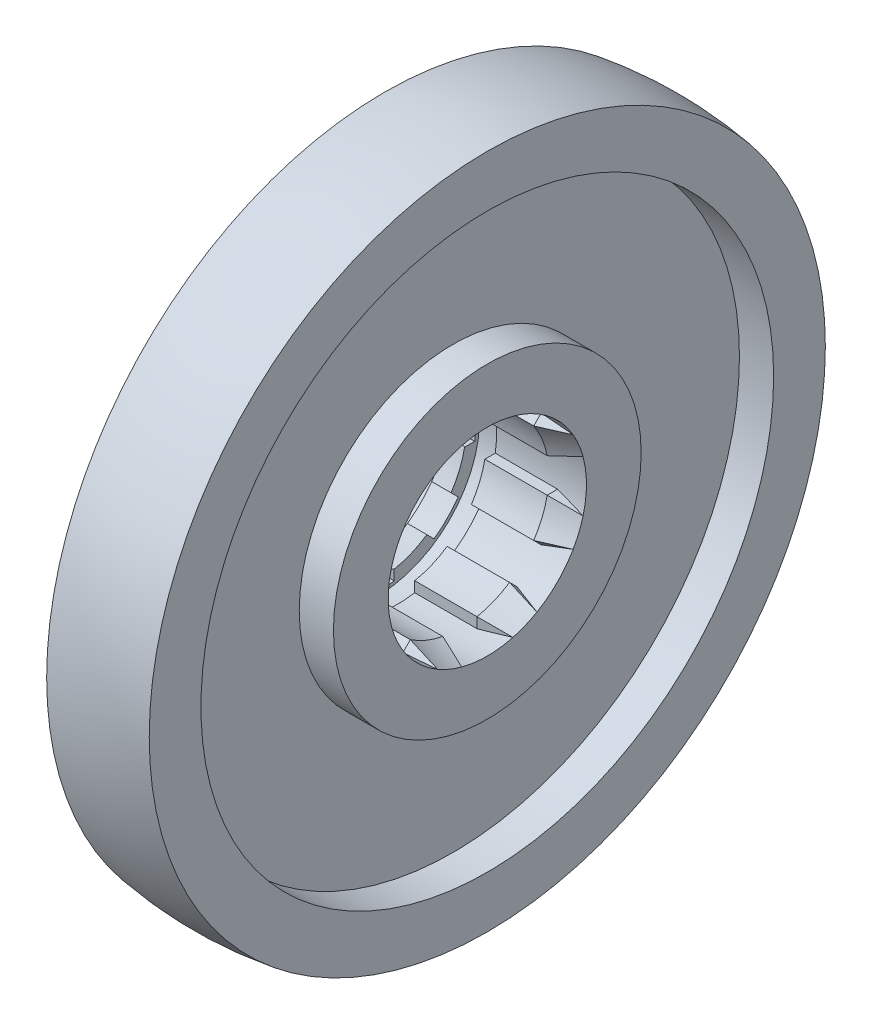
SolidWorks part; units mm, degrees
ref_plane "Vorne" through (0, 0, 0) normal (0, 0, 1) x (1, 0, 0)
ref_plane "Oben" through (0, 0, 0) normal (0, 1, 0) x (1, 0, 0)
ref_plane "Rechts" through (0, 0, 0) normal (1, 0, 0) x (0, 0, -1)
sketch "Skizze1" plane through (0, 0, 0) normal (0, 0, 1) x (1, 0, 0)
  line L0 (-45, 31) -> (-25, 31)
  line L1 (-25, 31) -> (-25, 26)
  line L2 (-25, 26) -> (15, 26)
  line L3 (15, 26) -> (15, 45)
  line L4 (15, 45) -> (5, 45)
  line L5 (5, 45) -> (5, 83.75)
  line L6 (5, 83.75) -> (15, 83.75)
  line L7 (15, 83.75) -> (15, 98.8686)
  line L8 (-45, 31) -> (-45, 45)
  line L9 (-45, 45) -> (-40, 45)
  line L10 (-40, 45) -> (-40, 40)
  line L11 (-40, 40) -> (-30, 40)
  line L12 (-30, 40) -> (-30, 45)
  line L13 (-30, 45) -> (-5, 45)
  line L14 (-5, 45) -> (-5, 83.75)
  line L15 (-5, 83.75) -> (-15, 83.75)
  line L16 (-15, 83.75) -> (-15, 98.8686)
  line L17 (0, 0) -> (0, 72.015) construction
  line L18 (0, 0) -> (-49.4649, 0) construction
  arc A0 (15, 98.8686) -> (-15, 98.8686) centre (0, 0) ccw
  dimension "D10" = 100
  dimension "D1" = 52
  dimension "D2" = 90
  dimension "D3" = 62
  dimension "D4" = 5
  dimension "D5" = 5
  dimension "D6" = 10
  dimension "D7" = 60
  dimension "D8" = 30
  dimension "D9" = 10
  dimension "D11" = 167.5
  dimension "D12" = 20
revolve "Rotation1" add sketch "Skizze1" angle 360 about L18
sketch "Skizze2" plane through (-25, 0, 0) normal (-1, 0, 0) x (0, 0, 1)
  line L0 (0, 0) -> (0, 34.1995) construction
  line L1 (-5, 28.5657) -> (-5, 25.5147)
  line L2 (5, 28.5657) -> (5, 25.5147)
  circle A0 centre (0, 0) radius 26 construction
  circle A1 centre (0, 0) radius 26
  arc A2 (5, 28.5657) -> (-5, 28.5657) centre (0, 0) ccw
  dimension "D2" = 29
  dimension "D1" = 10
extrude "Schnitt-Linear austragen1" cut sketch "Skizze2" against normal through all contours L0 A1 L2 A2 | L0 A2 L1 M1
ref_axis "Achse1" through (-48, 0, 0) along (1, 0, 0)
chamfer "Fase3" distance 8 distance2 2.5 1 edges at (15, 27.0402, -5)
chamfer "Fase4" distance 2.5 distance2 8 1 edges at (15, 27.0402, 5)
pattern_circular "Kreismuster1" count 8 over 360 about axis through (0, 0, 0) along (1, 0, 0) of "Fase4", "Schnitt-Linear austragen1", "Fase3"
chamfer "Fase5" distance 3 distance2 8 40 edges at (15, 24.0092, 13.4026) (11.0246, 22.2692, 13.4195) (15, 7.5, 26.4541) (11.0246, 6.2577, 25.2357) (15, -13.4026, 24.0092) (11.0246, -13.4195, 22.2692) (15, -26.4541, 7.5) (11.0246, -25.2357, 6.2577) (15, -24.0092, -13.4026) (11.0246, -22.2692, -13.4195) (15, -7.5, -26.4541) (11.0246, -6.2577, -25.2357) (15, 13.4026, -24.0092) (11.0246, 13.4195, -22.2692) (15, 9.9498, 24.0209) (11.0246, 13.4195, 22.2692) (15, 13.4026, 24.0092) (15, -9.9498, 24.0209) (11.0246, -6.2577, 25.2357) (15, -7.5, 26.4541) (15, -24.0209, 9.9498) (11.0246, -22.2692, 13.4195) (15, -24.0092, 13.4026) (15, -24.0209, -9.9498) (11.0246, -25.2357, -6.2577) (15, -26.4541, -7.5) (15, -9.9498, -24.0209) (11.0246, -13.4195, -22.2692) (15, -13.4026, -24.0092) (15, 9.9498, -24.0209) (11.0246, 6.2577, -25.2357) (15, 7.5, -26.4541) (15, 24.0209, -9.9498) (11.0246, 22.2692, -13.4195) (15, 24.0092, -13.4026) (15, 26.4541, -7.5) (11.0246, 25.2357, -6.2577) (15, 24.0209, 9.9498) (11.0246, 25.2357, 6.2577) (15, 26.4541, 7.5)
chamfer "Fase6" distance 8 distance2 3 24 edges at (-25, -24.0209, -9.9498) (-25, -27.0402, -5) (-25, -27.0402, 5) (-25, -9.9498, -24.0209) (-25, -15.5848, -22.6558) (-25, -22.6558, -15.5848) (-25, 9.9498, -24.0209) (-25, 5, -27.0402) (-25, -5, -27.0402) (-25, 24.0209, -9.9498) (-25, 22.6558, -15.5848) (-25, 15.5848, -22.6558) (-25, 24.0209, 9.9498) (-25, 27.0402, 5) (-25, 27.0402, -5) (-25, 9.9498, 24.0209) (-25, 15.5848, 22.6558) (-25, 22.6558, 15.5848) (-25, -9.9498, 24.0209) (-25, -5, 27.0402) (-25, 5, 27.0402) (-25, -24.0209, 9.9498) (-25, -22.6558, 15.5848) (-25, -15.5848, 22.6558)
sketch "Skizze4" plane through (0, 0, 0) normal (0, 0, 1) x (1, 0, 0)
  line L0 (-15, 45) -> (-30, 41)
  line L1 (-5, 45) -> (-30, 45) construction
  line L2 (-30, 45) -> (-30, -45) construction
  line L3 (-30, 41) -> (-30, 45)
  line L4 (-30, 45) -> (-15, 45)
  dimension "D1" = 15
  dimension "D2" = 4
extrude "Schnitt-Linear austragen2" cut sketch "Skizze4" against normal up to next and the other way up to next
hole_wizard "M6x1.0 Gewindekernloch1" positions "Skizze7" profile "Skizze6" tap size "M6x1.0" standard "DIN"
sketch "Skizze7" plane through (-12.1992, 45.7469, 0) normal (-0.2577, 0.9662, 0) x (-0.9662, -0.2577, 0)
  line L0 (0, 0) -> (20.2527, 0) construction
  line L1 (18.4229, 18.5472) -> (18.4229, -18.5472) construction
  point P0 (6.4229, 0)
  dimension "D1" = 12
sketch "Skizze6" plane through (-18.4052, 44.092, 0) normal (0, 0, 1) x (-0.9662, -0.2577, 0)
  line L0 (0, 0) -> (0, 19.5)
  line L1 (0, 19.5) -> (2.5, 17)
  line L2 (2.5, 17) -> (2.5, 12)
  line L3 (2.5, 12) -> (3, 12)
  line L4 (3, 12) -> (3, 0)
  line L5 (3, 0) -> (0, 0)
  line L10 (0, 19.5) -> (-2.5, 17) construction
  line L11 (0, -6.35) -> (0, 107.95) construction
  dimension "Bohrerdurchmesser" = 5
  dimension "Bohrungstiefe" = 17
  dimension "Nenndurchmesser" = 6
  dimension "Gewindelänge" = 12
  dimension "Spitzenwinkel" = 90
sketch "Skizze8" plane through (0, 0, 0) normal (0, 0, 1) x (1, 0, 0)
  line L0 (-17.2347, 30) -> (-17.2347, 0)
  line L1 (-17.7288, 31.853) -> (-16.968, 29) construction
  line L2 (-17.2347, 0) -> (-11.2347, 0)
  line L3 (-11.2347, 0) -> (-11.2347, 30)
  line L6 (-17.2347, 30) -> (-11.2347, 30)
  dimension "D1" = 30
  dimension "D2" = 6
revolve "Schnitt-Rotation1" cut sketch "Skizze8" angle 360 about axis through (-48, 0, 0) along (1, 0, 0)
